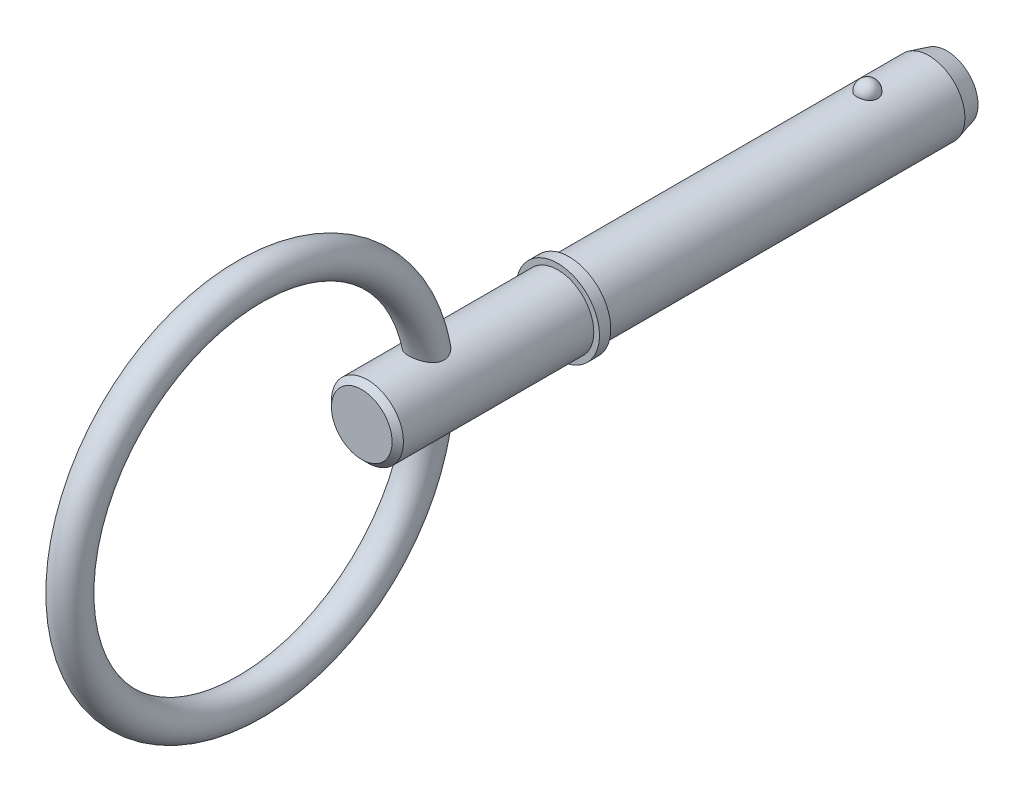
SolidWorks part; units mm, degrees
ref_plane "Front Plane" through (0, 0, 0) normal (0, 0, 1) x (1, 0, 0)
ref_plane "Top Plane" through (0, 0, 0) normal (0, 1, 0) x (1, 0, 0)
ref_plane "Right Plane" through (0, 0, 0) normal (1, 0, 0) x (0, 0, -1)
sketch "Sketch2" plane through (0, 0, 0) normal (0, 0, 1) x (1, 0, 0)
  circle A0 centre (0, 0) radius 3.175
  point P3 (0, 3.175)
  dimension "D1" = 6.35
extrude "Boss-Extrude1" add sketch "Sketch2" along normal blind 25.4
sketch "Sketch3" plane through (0, 0, 0) normal (0, 0, -1) x (-1, 0, 0)
  circle A0 centre (0, 0) radius 3.175
  dimension "D1" = 6.35
extrude "Boss-Extrude2" add sketch "Sketch3" along normal blind 7.92
chamfer "Chamfer1" distance 1.586 angle 15 1 edges at (-3.175, 0, -7.92)
sketch "Sketch18" plane through (0, 0, 0) normal (1, 0, 0) x (0, 0, -1)
  line L0 (6.334, 3.175) -> (-25.4, 3.175) construction
  line L1 (0.91, 4.085) -> (0.91, 2.265)
  line L2 (-25.4, -3.175) -> (6.334, -3.175) construction
  arc A0 (0.91, 4.085) -> (0.91, 2.265) centre (0.91, 3.175) ccw
  point P4 (0, 3.175)
  dimension "D1" = 7.26
revolve "Revolve1" add sketch "Sketch18" angle 360 about L1
sketch "Sketch19" plane through (0, 0, 0) normal (1, 0, 0) x (0, 0, -1)
  line L0 (-33.7288, 0) -> (-46.4542, 0) construction
sketch "Sketch20" plane through (0, 0, 0) normal (1, 0, 0) x (0, 0, -1)
  line L0 (-25.4, 0) -> (-25.4, 3.675)
  line L1 (-25.4, 3.175) -> (-25.4, -3.175) construction
  line L2 (-25.4, 3.675) -> (-26.4, 3.675)
  line L3 (-26.4, 3.675) -> (-26.4, 0)
  line L4 (-33.7288, 0) -> (-46.4542, 0) construction
  line L5 (-26.4, 0) -> (-25.4, 0)
  dimension "D1" = 3.675
  dimension "D2" = 1
revolve "Revolve2" add sketch "Sketch20" angle 360 about L0
sketch "Sketch21" plane through (0, 0, 25.4) normal (0, 0, -1) x (-1, 0, 0)
  circle A0 centre (0, 0) radius 3.175
  dimension "D1" = 6.35
extrude "Boss-Extrude3" add sketch "Sketch21" against normal blind 18.29
chamfer "Chamfer2" distance 0.5 angle 45 1 edges at (-3.175, 0, 43.69)
sketch "Sketch23" plane through (0, 0, 0) normal (1, 0, 0) x (0, 0, -1)
  line L0 (-43.69, 2.675) -> (-43.69, -2.675) construction
  circle A0 centre (-53.565, 0) radius 15.875
  point P2 (-37.69, 0)
  dimension "D1" = 31.75
  dimension "D2" = 6
sketch "Sketch24" plane through (0, 0, 0) normal (0, 1, 0) x (1, 0, 0)
  circle A0 centre (0, -37.69) radius 1.5
  dimension "D1" = 3
sweep "Sweep1" add profiles "Sketch24" path "Sketch23"
